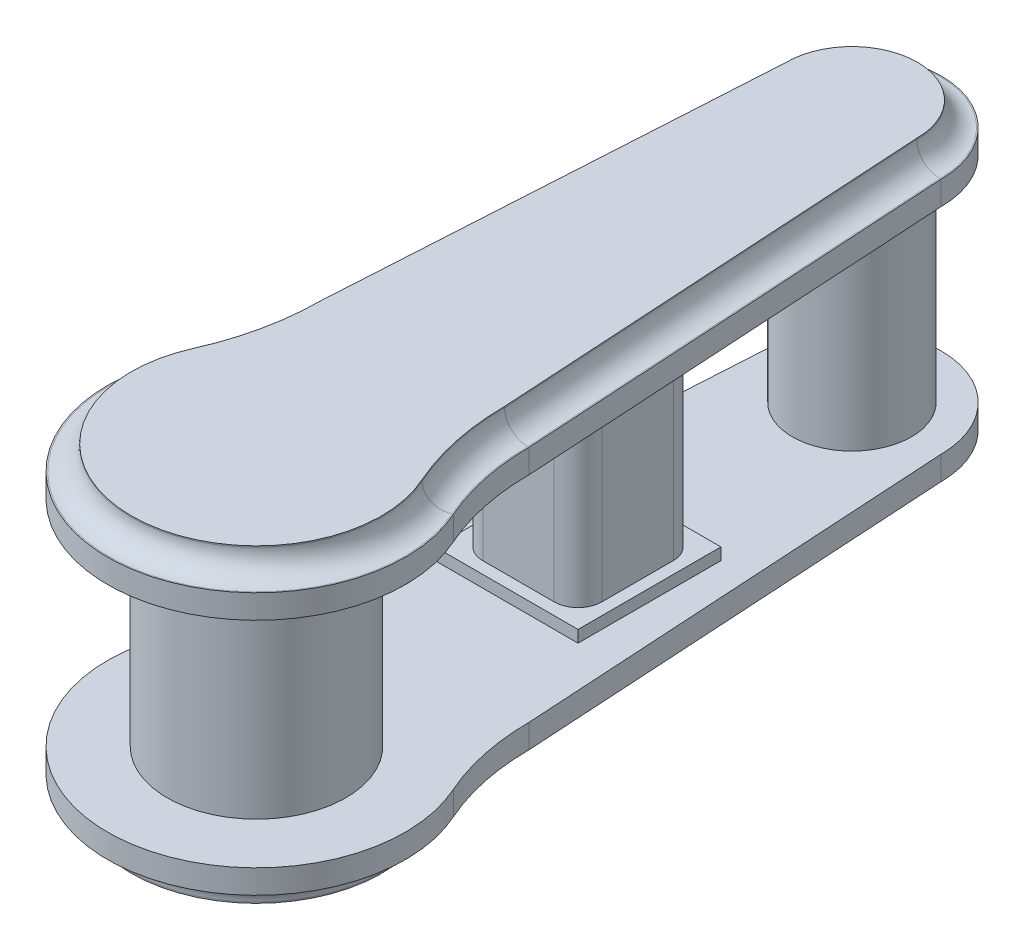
SolidWorks part; units mm, degrees
ref_plane "Front Plane" through (0, 0, 0) normal (0, 0, 1) x (1, 0, 0)
ref_plane "Top Plane" through (0, 0, 0) normal (0, 1, 0) x (1, 0, 0)
ref_plane "Right Plane" through (0, 0, 0) normal (1, 0, 0) x (0, 0, -1)
sketch "Sketch1" plane through (0, 0, 0) normal (0, 1, 0) x (1, 0, 0)
  circle A0 centre (0, 0) radius 75
  circle A1 centre (0, 500) radius 50
  point P5 (0, 0)
  dimension "D1" = 150
  dimension "D2" = 100
  dimension "D3" = 500
extrude "Boss-Extrude1" add sketch "Sketch1" along normal mid plane 180
sketch "Sketch2" plane through (0, 90, 0) normal (0, 1, 0) x (1, 0, 0)
  line L0 (75, 500) -> (96.99, 131.98)
  line L1 (0, 856.607) -> (0, -411.2567) construction
  line L2 (-75, 500) -> (-96.99, 131.98)
  arc A0 (96.99, 131.98) -> (113.8714, 51.5588) centre (296.99, 131.98) ccw
  arc A1 (-113.8714, 51.5588) -> (113.8714, 51.5588) centre (0, 0) ccw
  arc A2 (75, 500) -> (-75, 500) centre (0, 500) ccw
  arc A3 (-96.99, 131.98) -> (-113.8714, 51.5588) centre (-296.99, 131.98) cw
  dimension "D1" = 400
  dimension "D4" = 250
  dimension "D5" = 150
  dimension "D2" = 131.98
  dimension "D3" = 296.99
  dimension "D6" = 500
extrude "Boss-Extrude2" add sketch "Sketch2" along normal blind 20
sketch "Sketch4" plane through (0, 110, 0) normal (0, 1, 0) x (1, 0, 0)
  line L4 (76.9908, 131.3688) -> (54.9972, 499.4492)
  line L5 (-54.9972, 499.4492) -> (-76.9908, 131.3688)
  line L6 (76.9908, 131.3688) -> (54.9972, 499.4492)
  line L7 (-54.9972, 499.4492) -> (-76.9908, 131.3688)
  arc A8 (-95.6083, 43.4058) -> (-76.9908, 131.3688) centre (-296.99, 131.98) ccw
  arc A9 (-95.6083, 43.4058) -> (95.6083, 43.4058) centre (0, 0) ccw
  arc A10 (76.9908, 131.3688) -> (95.6083, 43.4058) centre (296.99, 131.98) ccw
  arc A11 (54.9972, 499.4492) -> (-54.9972, 499.4492) centre (0, 500) ccw
  arc A12 (-95.6083, 43.4058) -> (-76.9908, 131.3688) centre (-296.99, 131.98) ccw
  arc A13 (-95.6083, 43.4058) -> (95.6083, 43.4058) centre (0, 0) ccw
  arc A14 (76.9908, 131.3688) -> (95.6083, 43.4058) centre (296.99, 131.98) ccw
  arc A15 (54.9972, 499.4492) -> (-54.9972, 499.4492) centre (0, 500) ccw
  dimension "D1" = 20
extrude "Boss-Extrude3" add sketch "Sketch4" along normal blind 20
fillet "Fillet1" radius 19 6 edges at (-65.994, 110, -315.409) (0, 110, -555) (65.994, 110, -315.409) (0, 110, 105) (81.7579, 110, -86.4261) (-81.7579, 110, -86.4261)
mirror "Mirror1" about plane through (0, 0, 0) normal (0, 1, 0) of "Boss-Extrude3", "Fillet1", "Boss-Extrude2"
sketch "Sketch6" plane through (0, 90, 0) normal (0, -1, 0) x (1, 0, 0)
  line L1 (60, -210) -> (-60, -210)
  line L2 (60, -210) -> (60, -330)
  line L3 (60, -330) -> (-60, -330)
  line L4 (-60, -210) -> (-60, -330)
  line L5 (60, -210) -> (-60, -330) construction
  line L6 (60, -330) -> (-60, -210) construction
  point P0 (0, -270)
  point P5 (0, 0)
  dimension "D1" = 120
  dimension "D2" = 120
  dimension "D3" = 270
extrude "Boss-Extrude4" add sketch "Sketch6" along normal blind 10
mirror "Mirror2" about plane through (0, 0, 0) normal (0, 1, 0) of "Boss-Extrude4"
sketch "Sketch8" plane through (0, 80, 0) normal (0, -1, 0) x (1, 0, 0)
  line L8 (-50, -220) -> (-50, -320)
  line L9 (-50, -320) -> (50, -320)
  line L10 (50, -320) -> (50, -220)
  line L11 (50, -220) -> (-50, -220)
  line L12 (-50, -220) -> (-50, -320)
  line L13 (-50, -320) -> (50, -320)
  line L14 (50, -320) -> (50, -220)
  line L15 (50, -220) -> (-50, -220)
  dimension "D1" = 10
extrude "Boss-Extrude5" add sketch "Sketch8" along normal up to next
fillet "Fillet2" radius 20 4 edges at (-50, 0, -220) (50, 0, -220) (50, 0, -320) (-50, 0, -320)
